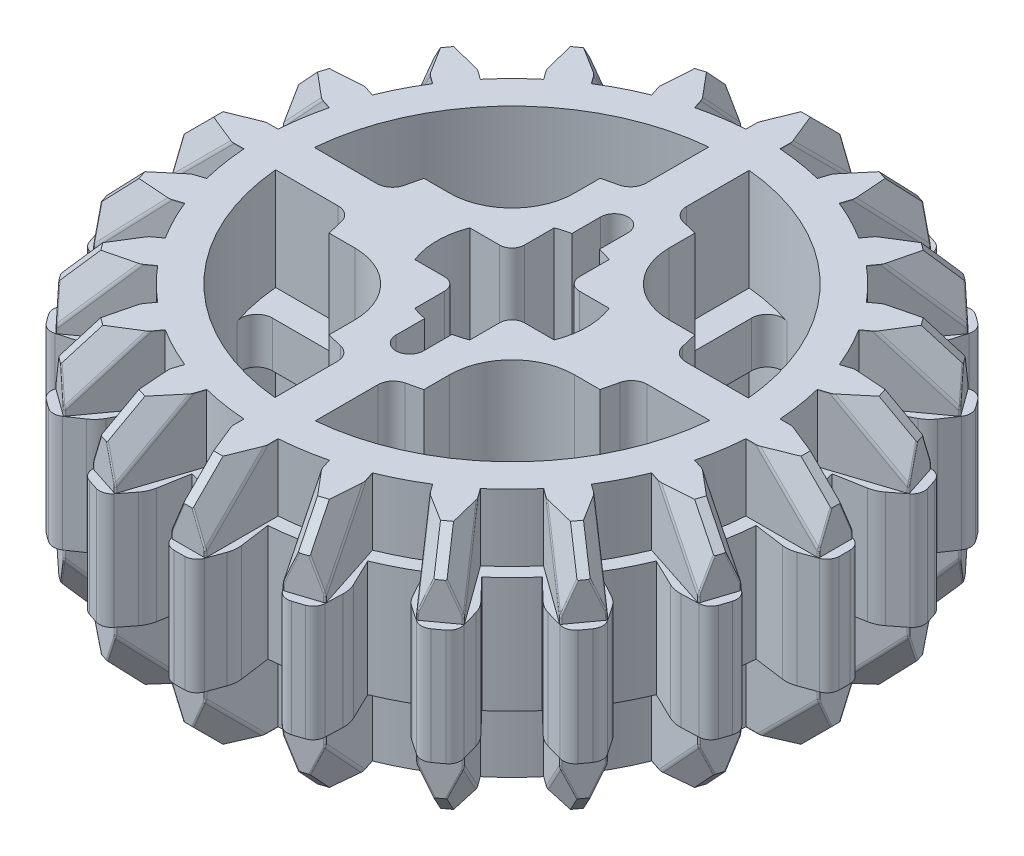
SolidWorks part; units mm, degrees
ref_plane "Front Plane" through (0, 0, 0) normal (0, 0, 1) x (1, 0, 0)
ref_plane "Top Plane" through (0, 0, 0) normal (0, 1, 0) x (1, 0, 0)
ref_plane "Right Plane" through (0, 0, 0) normal (1, 0, 0) x (0, 0, -1)
imported_body "Imported1"
sketch "Sketch1" plane through (0, 4.0325, 0) normal (0, 1, 0) x (1, 0, 0)
  line L0 (-4.3493, 0.9514) -> (-1.6605, 1.6756)
  line L1 (-1.6605, 1.6756) -> (-0.8232, 4.3753)
  line L2 (0.9234, 4.3553) -> (1.6001, 1.6756)
  line L3 (1.6001, 1.6756) -> (4.3493, 0.9514)
  line L4 (4.3493, -0.9514) -> (1.6001, -1.9473)
  line L5 (1.6001, -1.9473) -> (0.9234, -4.3553)
  line L6 (-1.032, -4.3309) -> (-1.6605, -1.9473)
  line L7 (-1.6605, -1.9473) -> (-4.3493, -0.9514)
  arc A0 (-4.3493, 0.9514) -> (-4.3493, -0.9514) centre (0, 0) ccw
  arc A2 (0.9234, 4.3553) -> (-0.8232, 4.3753) centre (0, 0) ccw
  arc A3 (4.3493, -0.9514) -> (4.3493, 0.9514) centre (0, 0) ccw
  arc A4 (-1.032, -4.3309) -> (0.9234, -4.3553) centre (0, 0) ccw
extrude "Boss-Extrude1" add sketch "Sketch1" against normal up to surface (8.065 mm away)
sketch "Sketch2" plane through (0, 4.0325, 0) normal (0, 1, 0) x (1, 0, 0)
  circle A0 centre (0, 0) radius 11.4478
extrude "Cut-Extrude1" cut sketch "Sketch2" against normal blind 0.0325
mirror "Mirror1" about plane through (0, 0, 0) normal (0, 1, 0) of "Cut-Extrude1"
sketch "Sketch3" plane through (0, 4, 0) normal (0, 1, 0) x (1, 0, 0)
  line L0 (-0.88, 2.2328) -> (-0.88, 1.28)
  line L1 (0.88, -2.2328) -> (0.88, -1.28)
  line L2 (2.2328, 0.88) -> (1.28, 0.88)
  line L3 (-2.2328, -0.88) -> (-1.28, -0.88)
  line L4 (-0.44, 3.28) -> (-0.44, 2.3593)
  line L5 (0.44, 3.28) -> (0.44, 2.3593)
  line L8 (-1.28, 0.88) -> (-2.2328, 0.88)
  line L9 (-0.44, -2.3593) -> (-0.44, -3.28)
  line L10 (0.44, -2.3593) -> (0.44, -3.28)
  line L11 (1.28, -0.88) -> (2.2328, -0.88)
  line L12 (0.88, 1.28) -> (0.88, 2.2328)
  line L13 (-0.88, -1.28) -> (-0.88, -2.2328)
  arc A0 (-0.44, 2.3593) -> (-0.88, 2.2328) centre (0, 0) ccw
  arc A1 (-0.44, 3.28) -> (0.44, 3.28) centre (0, 3.28) cw
  arc A2 (-0.44, -3.28) -> (0.44, -3.28) centre (0, -3.28) ccw
  arc A3 (0.88, 2.2328) -> (0.44, 2.3593) centre (0, 0) ccw
  arc A4 (2.2328, -0.88) -> (2.2328, 0.88) centre (0, 0) ccw
  arc A5 (0.44, -2.3593) -> (0.88, -2.2328) centre (0, 0) ccw
  arc A6 (-0.88, -2.2328) -> (-0.44, -2.3593) centre (0, 0) ccw
  arc A7 (-2.2328, 0.88) -> (-2.2328, -0.88) centre (0, 0) ccw
  arc A8 (-1.28, -0.88) -> (-0.88, -1.28) centre (-1.28, -1.28) cw
  arc A9 (1.28, -0.88) -> (0.88, -1.28) centre (1.28, -1.28) ccw
  arc A10 (1.28, 0.88) -> (0.88, 1.28) centre (1.28, 1.28) cw
  arc A11 (-1.28, 0.88) -> (-0.88, 1.28) centre (-1.28, 1.28) ccw
  point P26 (-0.88, -0.88)
  point P31 (0.88, 0.88)
  dimension "D1" = 0.88
  dimension "D7" = 0.4
  dimension "D2" = 1.76
  dimension "D3" = 0.88
  dimension "D4" = 1.76
  dimension "D5" = 0.44
  dimension "D6" = 0.44
extrude "Cut-Extrude2" cut sketch "Sketch3" against normal through all
